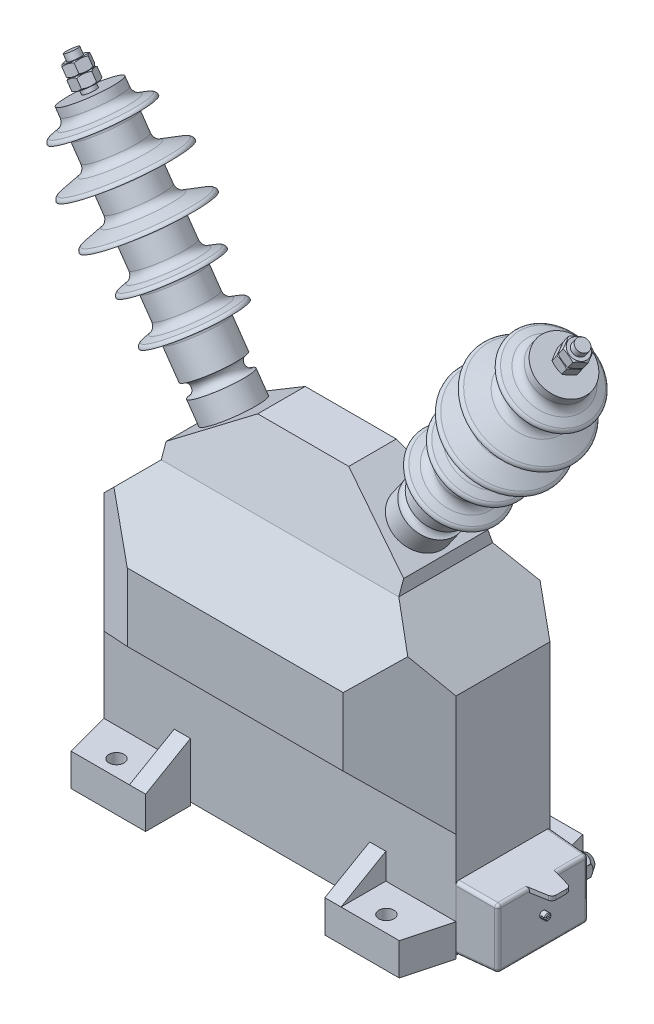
SolidWorks part; units mm, degrees
ref_plane "Front Plane" through (0, 0, 0) normal (0, 0, 1) x (1, 0, 0)
ref_plane "Top Plane" through (0, 0, 0) normal (0, 1, 0) x (1, 0, 0)
ref_plane "Right Plane" through (0, 0, 0) normal (1, 0, 0) x (0, 0, -1)
other "Join1"
other "29700-101_FM24_ksz_Kiöntött<1>@29700-100_FM24_ksz_Körvonalrajzhoz/29700-101_FM24_ksz_Test<1>@29700-101_FM24_ksz_Kiöntött/29700-110_KSZ24_Kivezetés<1>@29700-101_FM24_ksz_Test"
other "29700-101_FM24_ksz_Kiöntött<1>@29700-100_FM24_ksz_Körvonalrajzhoz/29700-101_FM24_ksz_Test<1>@29700-101_FM24_ksz_Kiöntött/29700-110_KSZ24_Kivezetés<2>@29700-101_FM24_ksz_Test"
other "29700-120_SzekunderFedélAssy<1>@29700-100_FM24_ksz_Körvonalrajzhoz/tomszelence<1>@29700-120_SzekunderFedélAssy"
other "29700-120_SzekunderFedélAssy<1>@29700-100_FM24_ksz_Körvonalrajzhoz/29516-122_SzekunderFedél<1>@29700-120_SzekunderFedélAssy"
other "29700-101_FM24_ksz_Kiöntött<1>@29700-100_FM24_ksz_Körvonalrajzhoz/29700-101_FM24_ksz_Test<1>@29700-101_FM24_ksz_Kiöntött/29700-101_FM24_ksz_Test<1>@29700-101_FM24_ksz_Test"
other "29700-120_SzekunderFedélAssy<1>@29700-100_FM24_ksz_Körvonalrajzhoz/21105-115_PlombaCsavar<1>@29700-120_SzekunderFedélAssy"
other "29700-101_FM24_ksz_Kiöntött<1>@29700-100_FM24_ksz_Körvonalrajzhoz/FME12_TRA_Földelőszem_22105_111<1>@29700-101_FM24_ksz_Kiöntött"
other "hatlapu-anya<1>@29700-100_FM24_ksz_Körvonalrajzhoz"
other "hatlapu-anya<2>@29700-100_FM24_ksz_Körvonalrajzhoz"
other "hatlapu-anya<3>@29700-100_FM24_ksz_Körvonalrajzhoz"
other "hatlapu-anya<4>@29700-100_FM24_ksz_Körvonalrajzhoz"
other "29700-120_SzekunderFedélAssy<1>@29700-100_FM24_ksz_Körvonalrajzhoz/hlf-tm-csavar<1>@29700-120_SzekunderFedélAssy"
